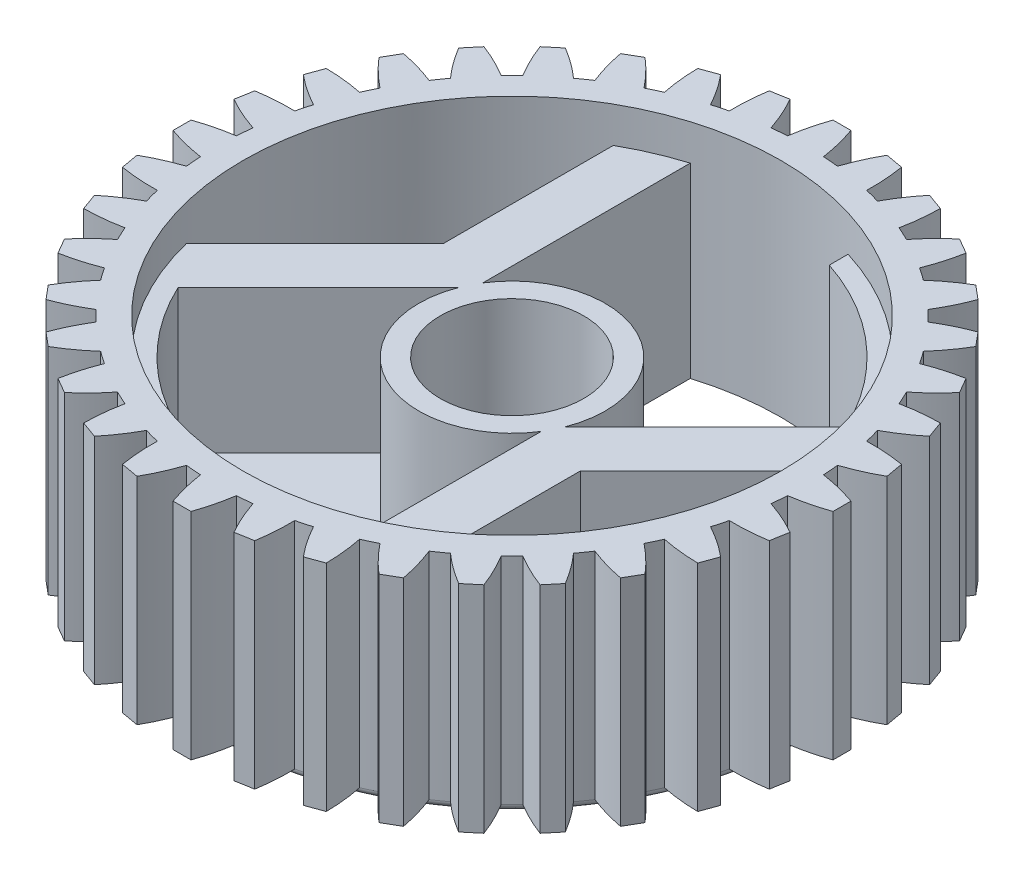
SolidWorks part; units mm, degrees
ref_plane "前视基准面" through (0, 0, 0) normal (0, 0, 1) x (1, 0, 0)
ref_plane "上视基准面" through (0, 0, 0) normal (0, 1, 0) x (1, 0, 0)
ref_plane "右视基准面" through (0, 0, 0) normal (1, 0, 0) x (0, 0, -1)
sketch "草图1" plane through (0, 0, 0) normal (0, 1, 0) x (1, 0, 0)
  circle A0 centre (0, 0) radius 8.2
  dimension "D1" = 16.4
extrude "凸台-拉伸1" add sketch "草图1" along normal blind 6.2
sketch "草图2" plane through (0, 6.2, 0) normal (0, 1, 0) x (1, 0, 0)
  circle A0 centre (0, 0) radius 7.5
  dimension "D1" = 15
extrude "切除-拉伸1" cut sketch "草图2" against normal blind 5
sketch "草图3" plane through (0, 1.2, 0) normal (0, 1, 0) x (1, 0, 0)
  line L0 (0, 7.5) -> (0, -7.5) construction
  line L1 (-2.2, 7.1701) -> (-2.2, 2.7)
  line L2 (2.2, 7.1701) -> (2.2, 2.7)
  line L3 (-2.2, 0) -> (2.2, 0) construction
  line L4 (-2.2, 7.5) -> (-2.2, -7.5) construction
  line L5 (2.2, 7.5) -> (2.2, -7.5) construction
  line L6 (-2.2, -2.7) -> (2.2, -2.7)
  line L7 (-2.2, 2.7) -> (2.2, 2.7)
  line L8 (-2.2, -2.7) -> (-2.2, -7.1701)
  line L9 (2.2, -2.7) -> (2.2, -7.1701)
  circle A0 centre (0, 0) radius 2
  circle A1 centre (0, 0) radius 7.5 construction
  arc A2 (2.2, 7.1701) -> (-2.2, 7.1701) centre (0, 0) ccw
  arc A3 (-2.2, -7.1701) -> (2.2, -7.1701) centre (0, 0) ccw
  dimension "D1" = 4
  dimension "D2" = 2.2
  dimension "D3" = 2.2
  dimension "D4" = 2.7
  dimension "D5" = 2.7
extrude "切除-拉伸2" cut sketch "草图3" against normal through all
sketch "草图4" plane through (0, 1.2, 0) normal (0, 1, 0) x (1, 0, 0)
  line L0 (2.2, -7.1701) -> (2.2, -1.3856)
  line L1 (3.7, -6.5238) -> (3.7, -1.7914)
  line L2 (2.4203, -0.9498) -> (6.3391, 2.9691)
  line L3 (3.7, -7.1701) -> (3.7, -1.1701) construction
  line L4 (3.7, -1.7914) -> (7.2829, 1.7915)
  line L5 (2.2, 7.1701) -> (2.2, 6.6453)
  line L6 (2.2, 2.7) -> (2.2, 7.1701) construction
  line L8 (2.2, -1.1701) -> (9.1336, 5.7635) construction
  line L9 (3.2607, -2.2307) -> (10.1942, 4.7028) construction
  line L10 (2.2, -7.1701) -> (2.2, -1.1701) construction
  circle A0 centre (0, 0) radius 2
  arc A1 (2.4203, -0.9498) -> (2.2, -1.3856) centre (0, 0) ccw
  arc A2 (7.2829, 1.7915) -> (2.2, 7.1701) centre (0, 0) ccw
  arc A3 (6.3391, 2.9691) -> (2.2, 6.6453) centre (0, 0) ccw
  arc A4 (2.2, -7.1701) -> (3.7, -6.5238) centre (0, 0) ccw
  dimension "D1" = 4
  dimension "D2" = 5.2
  dimension "D6" = 135
  dimension "D7" = 1.5
extrude "凸台-拉伸2" add sketch "草图4" along normal blind 4
pattern_circular "阵列(圆周)1" count 2 over 360 about axis through (0, 0, 0) along (0, 1, 0) of "凸台-拉伸2"
sketch "草图5" plane through (0, 6.2, 0) normal (0, 1, 0) x (1, 0, 0)
  line L0 (0, 8.2) -> (0, 9.2) construction
  line L1 (0.25, 9.2) -> (-0.25, 9.2)
  line L2 (0, 8.7) -> (-0.4, 8.7) construction
  line L3 (0, 8.2) -> (-0.5, 8.2) construction
  circle A0 centre (0, 0) radius 8.2 construction
  arc A1 (0.5023, 8.1846) -> (-0.5023, 8.1846) centre (0, 0) ccw
  arc A2 (-0.25, 9.2) -> (-0.5023, 8.1846) centre (4.925, 7.375) ccw
  arc A3 (0.25, 9.2) -> (0.5023, 8.1846) centre (-4.925, 7.375) cw
  dimension "D5" = 16.4
  dimension "D1" = 1
  dimension "D2" = 0.25
  dimension "D3" = 0.4
  dimension "D4" = 0.5
extrude "凸台-拉伸3" add sketch "草图5" against normal blind 6
pattern_circular "阵列(圆周)2" count 36 over 360 about axis through (0, 0, 0) along (0, 1, 0) of "凸台-拉伸3"
fillet "圆角1" radius 0.2 1 edges at (0, 0, 8.2)
